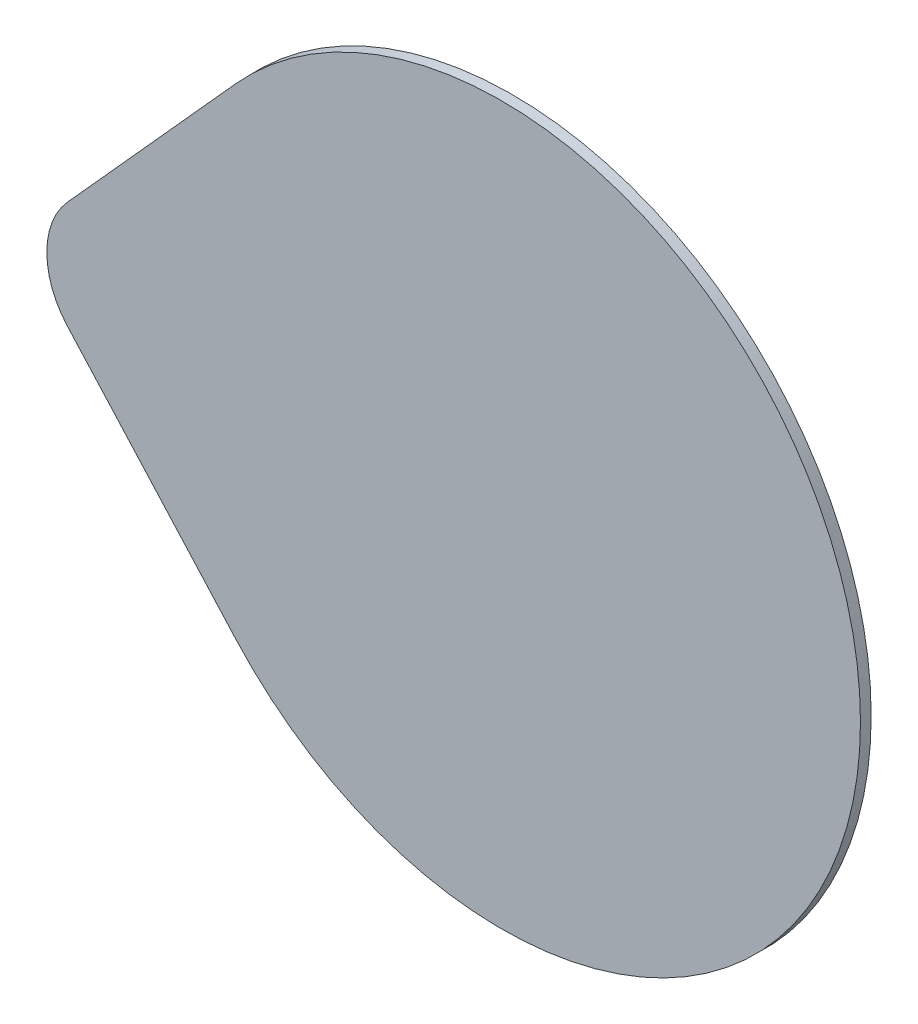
SolidWorks part; units mm, degrees
ref_plane "Face" through (0, 0, 0) normal (0, 0, 1) x (1, 0, 0)
ref_plane "Dessus" through (0, 0, 0) normal (0, 1, 0) x (1, 0, 0)
ref_plane "Droite" through (0, 0, 0) normal (1, 0, 0) x (0, 0, -1)
sketch "Esquisse1" plane through (0, 0, 0) normal (0, 0, 1) x (1, 0, 0)
  line L0 (0, 0) -> (-70.6222, 0) construction
  line L1 (-40.5714, 5.0209) -> (-24.8857, 22.4266)
  line L2 (-40.5714, -5.0209) -> (-24.8857, -22.4266)
  arc A0 (-24.8857, -22.4266) -> (-24.8857, 22.4266) centre (0, 0) ccw
  arc A1 (-40.5714, 5.0209) -> (-40.5714, -5.0209) centre (-35, 0) ccw
  dimension "D1" = 67
  dimension "D2" = 15
  dimension "D3" = 35
extrude "Base-Extrusion" add sketch "Esquisse1" along normal blind 1
